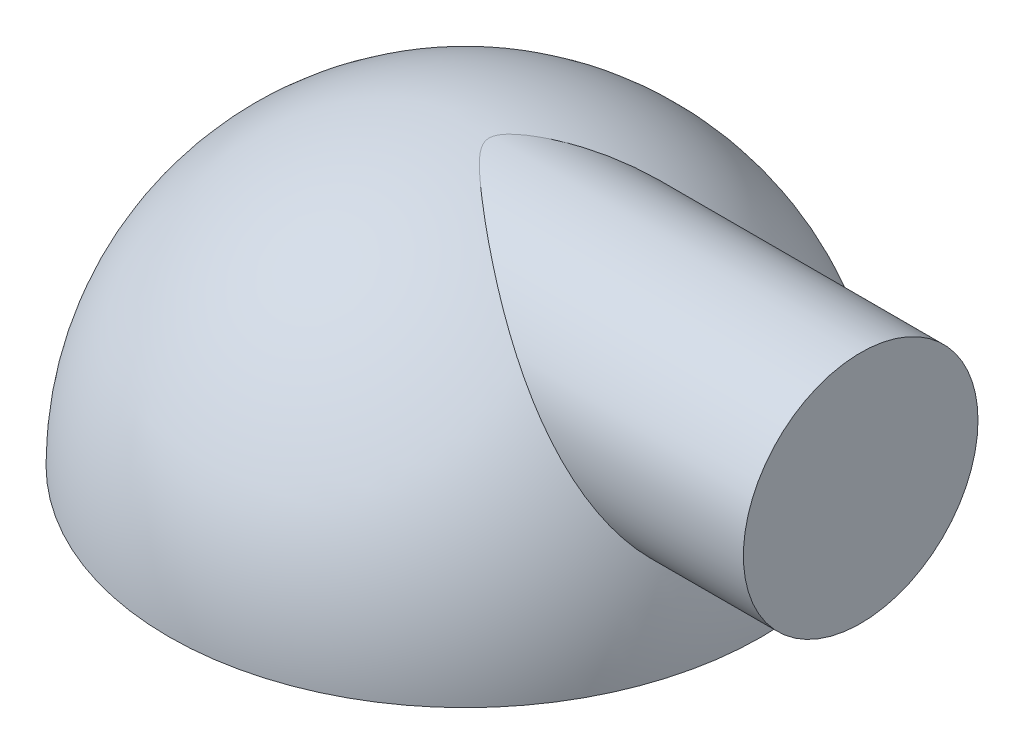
SolidWorks part; units mm, degrees
ref_plane "前视基准面" through (0, 0, 0) normal (0, 0, 1) x (1, 0, 0)
ref_plane "上视基准面" through (0, 0, 0) normal (0, 1, 0) x (1, 0, 0)
ref_plane "右视基准面" through (0, 0, 0) normal (1, 0, 0) x (0, 0, -1)
sketch "草图1" plane through (0, 0, 0) normal (0, 0, 1) x (1, 0, 0)
  line L0 (0, 49.3059) -> (0, -55.2824) construction
  line L1 (-61.0721, 0) -> (49.4926, 0) construction
  line L2 (-30, 0) -> (0, 0)
  line L3 (0, 0) -> (0, 30)
  arc A0 (0, 30) -> (-30, 0) centre (0, 0) ccw
  dimension "D1" = 30
  dimension "D2" = 30
revolve "旋转1" add sketch "草图1" angle 360 about L3
sketch "草图2" plane through (0, 0, 0) normal (1, 0, 0) x (0, 0, -1)
  line L0 (0, 50.5987) -> (0, -14.5301) construction
  circle A0 centre (0, 18.0343) radius 11.8693
extrude "拉伸1" add sketch "草图2" along normal blind 40
